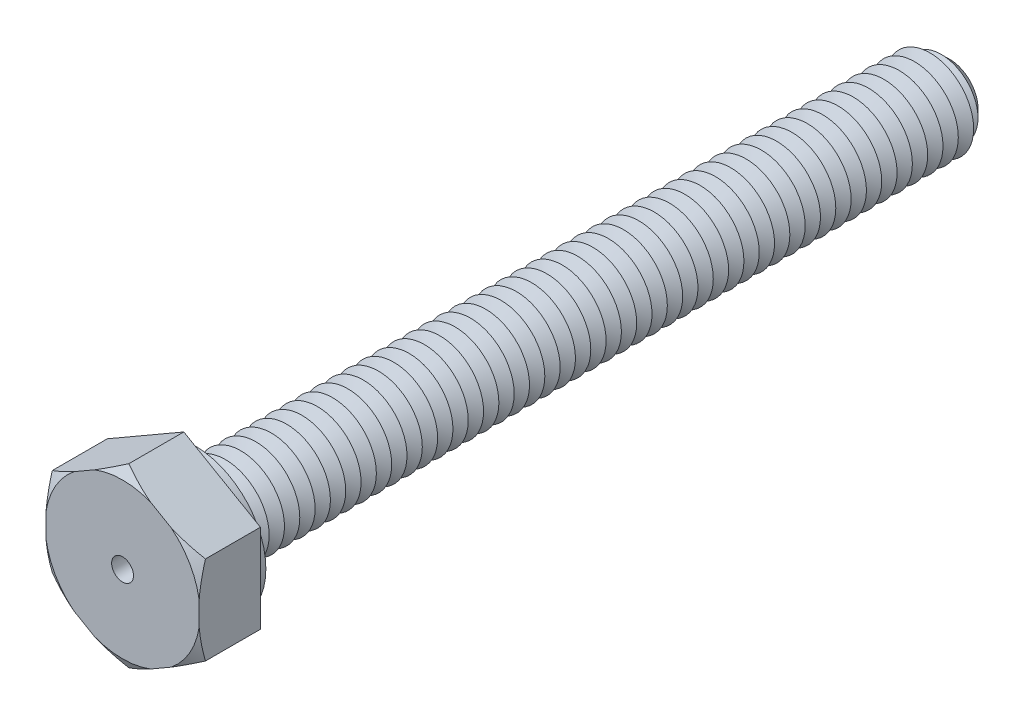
SolidWorks part; units mm, degrees
ref_plane "Front Plane" through (0, 0, 0) normal (0, 0, 1) x (1, 0, 0)
ref_plane "Top Plane" through (0, 0, 0) normal (0, 1, 0) x (1, 0, 0)
ref_plane "Right Plane" through (0, 0, 0) normal (1, 0, 0) x (0, 0, -1)
sketch "Sketch2" plane through (0, 0, 0) normal (0, 0, 1) x (1, 0, 0)
  line L1 (0, 4.0415) -> (-3.5, 2.0207)
  line L2 (-3.5, 2.0207) -> (-3.5, -2.0207)
  line L3 (-3.5, -2.0207) -> (0, -4.0415)
  line L4 (0, -4.0415) -> (3.5, -2.0207)
  line L5 (3.5, -2.0207) -> (3.5, 2.0207)
  line L6 (3.5, 2.0207) -> (0, 4.0415)
  circle A0 centre (0, 0) radius 3.5 construction
  dimension "D1" = 7
extrude "Boss-Extrude1" add sketch "Sketch2" along normal blind 2.8
sketch "Sketch3" plane through (0, 0, 0) normal (0, 0, -1) x (-1, 0, 0)
  circle A0 centre (0, 0) radius 2
  dimension "D1" = 4
extrude "Boss-Extrude2" add sketch "Sketch3" along normal blind 35
sketch "Sketch4" plane through (0, 0, 0) normal (0, 0, -1) x (-1, 0, 0)
  circle A0 centre (0, 0) radius 3.25
  dimension "D1" = 6.5
extrude "Boss-Extrude3" add sketch "Sketch4" along normal blind 0.5
sketch "Sketch5" plane through (0, 0, 0) normal (1, 0, 0) x (0, 0, -1)
  line L0 (-3.2117, 0) -> (6.3192, 0) construction
chamfer "Chamfer1" distance 0.7 angle 45 1 edges at (-2, 0, -35)
sketch "Sketch6" plane through (0, 0, 0) normal (1, 0, 0) x (0, 0, -1)
  line L0 (0.5, 2) -> (0.85, 1.3938)
  line L1 (0.85, 1.3938) -> (1.2, 2)
  line L2 (34.3, 2) -> (0.5, 2) construction
  line L3 (1.2, 2) -> (0.5, 2)
  dimension "D1" = 0.7
revolve "Cut-Revolve1" cut sketch "Sketch6" angle 360 about L0
pattern_linear "LPattern1" count 49 spacing 0.7 along (0, 0, -1) of "Cut-Revolve1"
sketch "Sketch7" plane through (0, 0, 0) normal (1, 0, 0) x (0, 0, -1)
  line L0 (-2.8, 4.0415) -> (-2.8, 3.5415)
  line L1 (-2.8, 2.0207) -> (-2.8, 4.0415) construction
  line L2 (-2.8, 3.5415) -> (-2.5113, 4.0415)
  line L3 (-2.8, 4.0415) -> (0, 4.0415) construction
  line L4 (-2.5113, 4.0415) -> (-2.8, 4.0415)
  dimension "D1" = 0.5
  dimension "D2" = 30
revolve "Cut-Revolve2" cut sketch "Sketch7" angle 360 about L0
sketch "Sketch8" plane through (0, 0, 2.8) normal (0, 0, 1) x (1, 0, 0)
  circle A0 centre (0, 0) radius 0.5
  dimension "D1" = 1
extrude "Cut-Extrude1" cut sketch "Sketch8" against normal up to surface (37.8 mm away)
